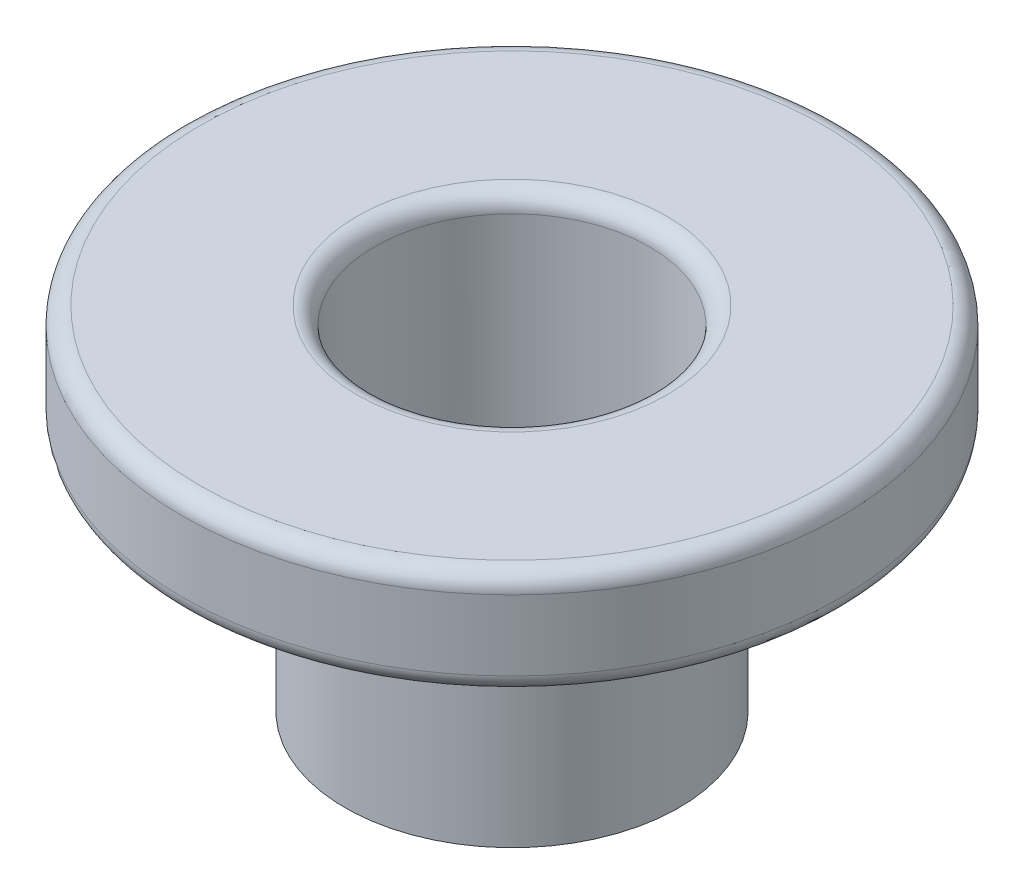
SolidWorks part; units mm, degrees
ref_plane "Front" through (0, 0, 0) normal (0, 0, 1) x (1, 0, 0)
ref_plane "Top" through (0, 0, 0) normal (0, 1, 0) x (1, 0, 0)
ref_plane "Right" through (0, 0, 0) normal (1, 0, 0) x (0, 0, -1)
sketch "Sketch1" plane through (0, 0, 0) normal (0, 0, 1) x (1, 0, 0)
  line L0 (1.9844, 0) -> (1.9844, 5.08)
  line L1 (1.9844, 5.08) -> (4.7625, 5.08)
  line L2 (4.7625, 5.08) -> (4.7625, 3.556)
  line L3 (4.7625, 3.556) -> (2.413, 3.556)
  line L4 (2.413, 3.556) -> (2.413, 0)
  line L5 (2.413, 0) -> (1.9844, 0)
  line L6 (0, 0) -> (0, 5.08) construction
  dimension "D1" = 2.413
  dimension "D2" = 1.9844
  dimension "D3" = 4.7625
  dimension "D4" = 1.524
  dimension "D5" = 5.08
revolve "Revolve1" add sketch "Sketch1" angle 360 about L6
fillet "Fillet1" radius 0.254 3 edges at (0, 5.08, -1.9844) (0, 5.08, -4.7625) (0, 3.556, -4.7625)
